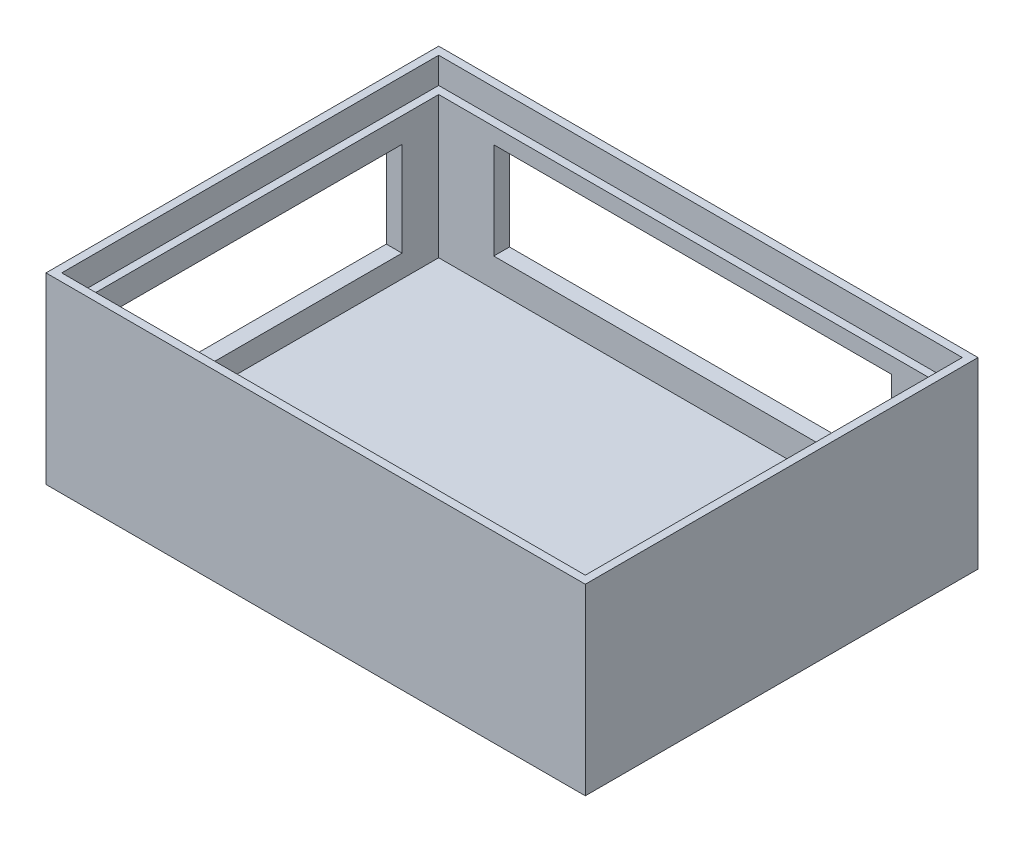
SolidWorks part; units mm, degrees
ref_plane "Plan de face" through (0, 0, 0) normal (0, 0, 1) x (1, 0, 0)
ref_plane "Plan de dessus" through (0, 0, 0) normal (0, 1, 0) x (1, 0, 0)
ref_plane "Plan de droite" through (0, 0, 0) normal (1, 0, 0) x (0, 0, -1)
sketch "Esquisse1" plane through (0, 0, 0) normal (0, 1, 0) x (1, 0, 0)
  line L1 (0, 0) -> (103, 0)
  line L2 (0, 0) -> (0, 75)
  line L3 (0, 75) -> (103, 75)
  line L4 (103, 0) -> (103, 75)
  dimension "D1" = 103
  dimension "D2" = 75
extrude "Boss.-Extru.1" add sketch "Esquisse1" along normal blind 35 contours L3 L4 L1 L2
shell "Coque2" thickness 3
sketch "Esquisse2" plane through (0, 0, 0) normal (0, 1, 0) x (1, 0, 0)
  line L0 (0, 75) -> (103, 75) construction
  line L1 (1.5, 1.5) -> (101.5, 1.5)
  line L2 (1.5, 1.5) -> (1.5, 73.5)
  line L3 (1.5, 73.5) -> (101.5, 73.5)
  line L4 (101.5, 1.5) -> (101.5, 73.5)
  line L5 (103, 0) -> (103, 75) construction
  line L6 (0, 0) -> (103, 0) construction
  line L7 (0, 0) -> (0, 75) construction
  dimension "D1" = 1.5
  dimension "D2" = 1.5
  dimension "D3" = 1.5
  dimension "D4" = 1.5
sketch "Esquisse3" plane through (0, 0, 0) normal (1, 0, 0) x (0, 0, -1)
  line L0 (37.5, 35) -> (37.5, 0) construction
  line L1 (65, 7.2591) -> (10, 7.2591)
  line L2 (65, 7.2591) -> (65, 25.2591)
  line L3 (65, 25.2591) -> (10, 25.2591)
  line L4 (10, 7.2591) -> (10, 25.2591)
  line L5 (0, 35) -> (75, 35) construction
  line L6 (0, 0) -> (75, 0) construction
  point P10 (37.5, 25.2591)
  dimension "D1" = 55
  dimension "D2" = 18
  dimension "D3" = 0
extrude "Enlèv. mat.-Extru.7" cut sketch "Esquisse3" along normal blind 31 contours L3 L4 L1 L2
sketch "Esquisse5" plane through (0, 0, 0) normal (0, 1, 0) x (1, 0, 0)
  line L0 (0, 75) -> (103, 75) construction
  line L5 (51.5, 75) -> (51.5, 0) construction
  line L6 (0, 0) -> (103, 0) construction
  line L7 (103, 37.5) -> (0, 37.5) construction
  line L8 (103, 0) -> (103, 75) construction
  line L9 (0, 0) -> (0, 75) construction
sketch "Esquisse6" plane through (0, 0, 0) normal (0, 1, 0) x (1, 0, 0)
  line L0 (85.6502, 54) -> (85.6502, 17) construction
  line L1 (85.6502, 17) -> (12.6502, 17) construction
  line L2 (12.6502, 17) -> (12.6502, 54) construction
  line L3 (12.6502, 54) -> (85.6502, 54) construction
sketch "Esquisse7" plane through (0, 0, 0) normal (0, 0, 1) x (1, 0, 0)
  line L0 (41.5, 35) -> (41.5, 15) construction
  line L1 (0, 35) -> (103, 35) construction
  line L2 (41.5, 15) -> (61.5, 15) construction
  line L3 (61.5, 15) -> (61.5, 35) construction
  line L4 (61.5, 35) -> (41.5, 35) construction
  point P4 (51.5, 35)
  dimension "D1" = 20
  dimension "D2" = 20
  dimension "D3" = 0
sketch "Esquisse10" plane through (0, 0, -75) normal (0, 0, -1) x (-1, 0, 0)
  line L0 (-103, 35) -> (-103, 0) construction
  line L1 (-89.4824, 8.5422) -> (-13.5176, 8.5422)
  line L2 (-89.4824, 8.5422) -> (-89.4824, 26.9578)
  line L3 (-89.4824, 26.9578) -> (-13.5176, 26.9578)
  line L4 (-13.5176, 8.5422) -> (-13.5176, 26.9578)
  line L5 (0, 35) -> (-103, 35) construction
  point P4 (-51.5, 26.9578)
  point P7 (-13.5176, 17.75)
  dimension "D1" = 51.5
  dimension "D2" = 17.25
extrude "Enlèv. mat.-Extru.9" cut sketch "Esquisse10" against normal blind 10
sketch "Esquisse11" plane through (0, 35, 0) normal (0, 1, 0) x (1, 0, 0)
  line L0 (0, 0) -> (103, 0) construction
  line L1 (101.5, 73.5) -> (1.5, 73.5)
  line L2 (101.5, 73.5) -> (101.5, 1.5)
  line L3 (101.5, 1.5) -> (1.5, 1.5)
  line L4 (1.5, 73.5) -> (1.5, 1.5)
  line L5 (103, 0) -> (103, 75) construction
  line L6 (0, 75) -> (103, 75) construction
  line L7 (0, 0) -> (0, 75) construction
  dimension "D1" = 1.5
  dimension "D2" = 1.5
  dimension "D3" = 1.5
  dimension "D4" = 1.5
extrude "Enlèv. mat.-Extru.12" cut sketch "Esquisse11" against normal blind 5
